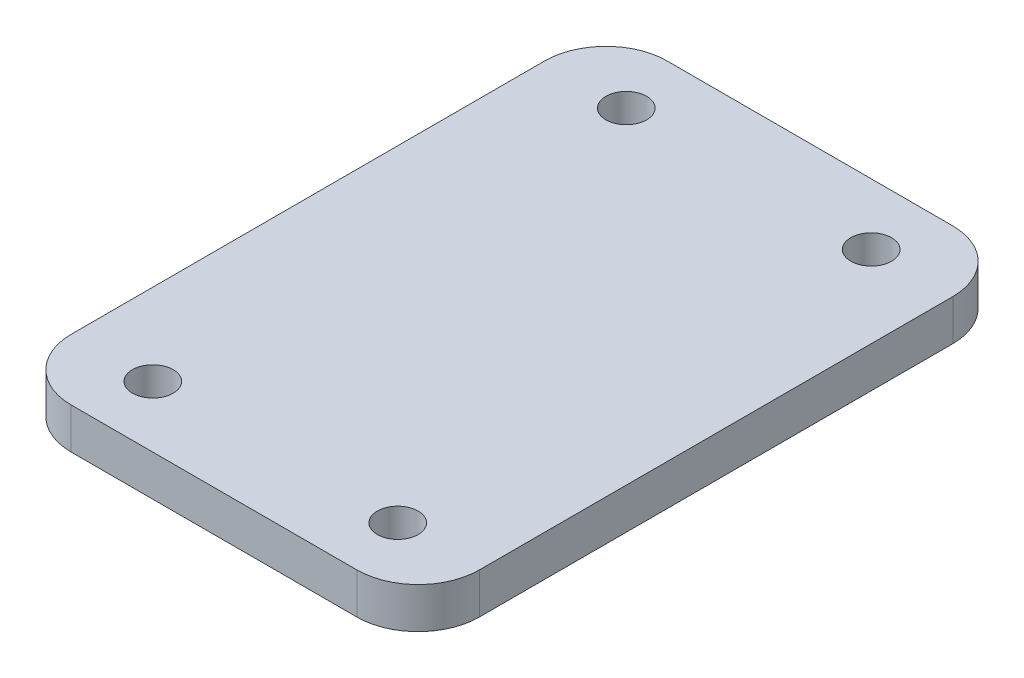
SolidWorks part; units mm, degrees
ref_plane "Front Plane" through (0, 0, 0) normal (0, 0, 1) x (1, 0, 0)
ref_plane "Top Plane" through (0, 0, 0) normal (0, 1, 0) x (1, 0, 0)
ref_plane "Right Plane" through (0, 0, 0) normal (1, 0, 0) x (0, 0, -1)
sketch "Sketch1" plane through (0, 0, 0) normal (0, 1, 0) x (1, 0, 0)
  line L1 (-50, -73) -> (50, -73)
  line L2 (-50, -73) -> (-50, 73)
  line L3 (-50, 73) -> (50, 73)
  line L4 (50, -73) -> (50, 73)
  line L5 (-50, -73) -> (50, 73) construction
  line L6 (-50, 73) -> (50, -73) construction
  point P0 (0, 0)
  dimension "D1" = 100
  dimension "D2" = 146
extrude "Boss-Extrude1" add sketch "Sketch1" along normal blind 10
fillet "Fillet1" radius 15 4 edges at (-50, 5, -73) (50, 5, -73) (50, 5, 73) (-50, 5, 73)
sketch "Sketch2" plane through (0, 10, 0) normal (0, 1, 0) x (1, 0, 0)
  line L0 (-35, -73) -> (35, -73) construction
  line L1 (-50, 58) -> (-50, -58) construction
  circle A0 centre (-30, -58) radius 5
  dimension "D1" = 10
  dimension "D2" = 15
  dimension "D3" = 20
extrude "Cut-Extrude1" cut sketch "Sketch2" against normal through all
pattern_linear "LPattern1" count 2 spacing 116 along (0, 0, -1) count 2 spacing 60 along (1, 0, 0) of "Cut-Extrude1"
